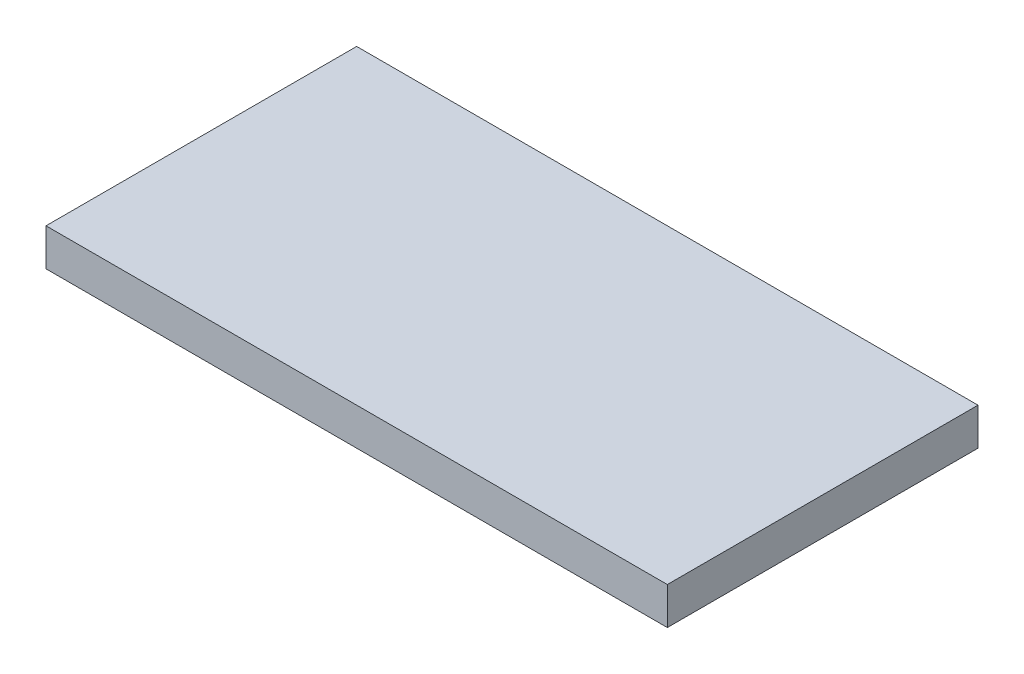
SolidWorks part; units mm, degrees
ref_plane "Front" through (0, 0, 0) normal (0, 0, 1) x (1, 0, 0)
ref_plane "Top" through (0, 0, 0) normal (0, 1, 0) x (1, 0, 0)
ref_plane "Right" through (0, 0, 0) normal (1, 0, 0) x (0, 0, -1)
sketch "Sketch1" plane through (0, 0, 0) normal (0, 1, 0) x (1, 0, 0)
  line L1 (0, 0) -> (50, 0)
  line L2 (0, 0) -> (0, 25)
  line L3 (0, 25) -> (50, 25)
  line L4 (50, 0) -> (50, 25)
  dimension "D1" = 50
  dimension "D2" = 25
extrude "Extrude1" add sketch "Sketch1" along normal blind 3
sketch "Sketch2" plane through (0, 3, 0) normal (0, 1, 0) x (-1, 0, 0)
  line L0 (-13.8982, 0) -> (-29.3326, 0)
  line L2 (-13.8982, 0) -> (-13.8982, -6.3956)
  line L3 (-29.3326, -6.3956) -> (-29.3326, 0)
  line L4 (0, 0) -> (-50, 0) construction
  arc A0 (-13.8982, -6.3956) -> (-29.3326, -6.3956) centre (-21.6154, -6.3956) cw
